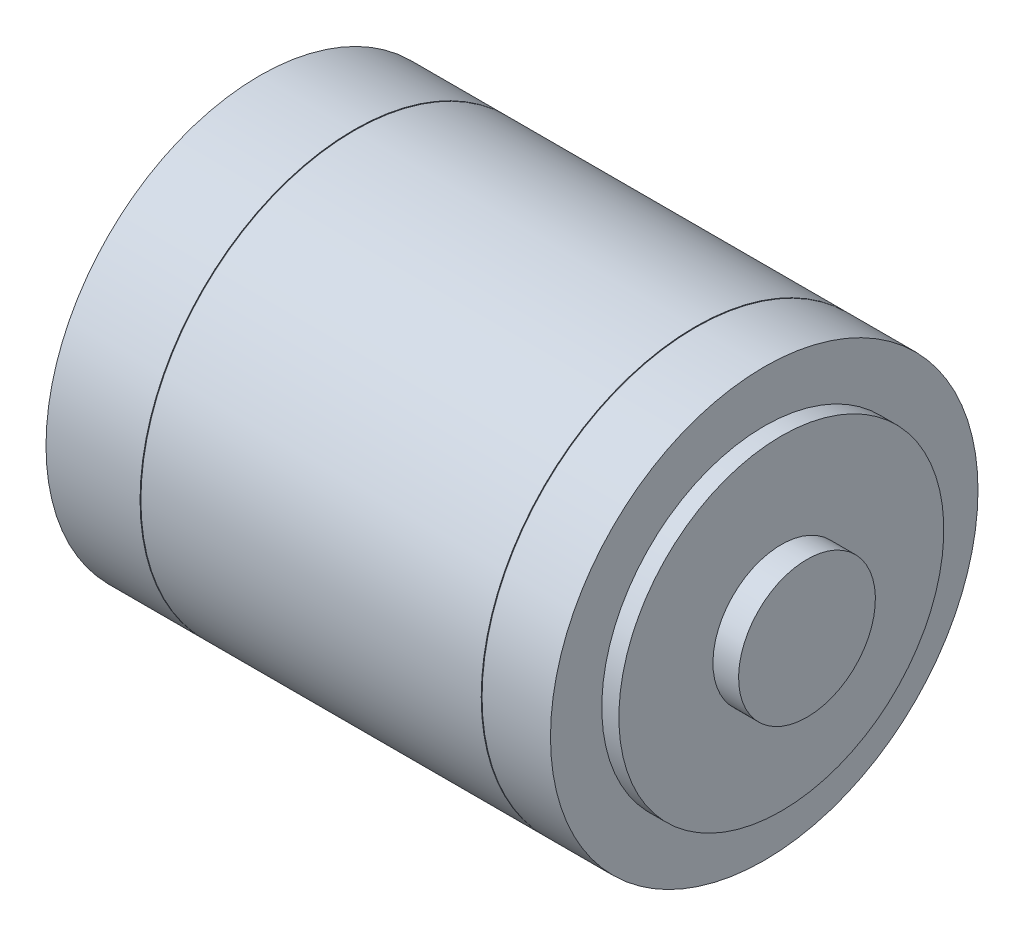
SolidWorks part; units mm, degrees
ref_plane "Plan1" through (0, 0, 0) normal (0, 0, 1) x (1, 0, 0)
ref_plane "Plan2" through (0, 0, 0) normal (0, 1, 0) x (1, 0, 0)
ref_plane "Plan3" through (0, 0, 0) normal (1, 0, 0) x (0, 0, -1)
sketch "Esquisse1" plane through (0, 0, 0) normal (0, 0, 1) x (1, 0, 0)
  line L0 (-67, 0) -> (-67, 15)
  line L1 (-67, 15) -> (-64, 15)
  line L2 (-64, 15) -> (-64, 25)
  line L3 (-64, 25) -> (-53, 25)
  line L4 (-53, 25) -> (-53, 24.9)
  line L5 (-53, 24.9) -> (-52.9, 24.9)
  line L6 (-52.9, 24.9) -> (-52.9, 25)
  line L7 (-52.9, 25) -> (-13.1, 25)
  line L8 (-13.1, 25) -> (-13.1, 24.9)
  line L9 (-13.1, 24.9) -> (-13, 24.9)
  line L10 (-13, 24.9) -> (-13, 25)
  line L11 (-13, 25) -> (-5, 25)
  line L12 (-5, 25) -> (-5, 19)
  line L13 (-92, 0) -> (31.2, 0) construction
  line L14 (-5, 19) -> (-3, 19)
  line L15 (-3, 19) -> (-3, 8)
  line L16 (-3, 8) -> (0, 8)
  line L17 (0, 8) -> (0, 0)
  line L20 (-67, 0) -> (0, 0)
  dimension "D1" = 3
  dimension "D2" = 15
  dimension "D3" = 25
  dimension "D4" = 0.1
  dimension "D5" = 0.1
  dimension "D6" = 0.1
  dimension "D7" = 0.1
  dimension "D8" = 25
  dimension "D9" = 25
  dimension "D10" = 8
  dimension "D11" = 11
  dimension "D12" = 2
  dimension "D13" = 19
  dimension "D14" = 3
  dimension "D15" = 8
  dimension "D16" = 59
revolve "Base-Révolution" add sketch "Esquisse1" angle 360 about L13
shell "Coque2" thickness 8
sketch "Esquisse2" plane through (-64, 0, 0) normal (-1, 0, 0) x (0, 0, 1)
  line L0 (0, 0) -> (0, 20) construction
  circle A0 centre (0, 0) radius 20 construction
  point P4 (0, 20)
  dimension "D1" = 40
hole_wizard "Trou taraudé M5x0.81" positions "Esquisse3" profile "Esquisse4" tap size "M5x0.8" standard "ISO"
sketch "Esquisse3" plane through (-64, 0, 0) normal (-1, 0, 0) x (0, 0, 1)
  point P0 (0, 20)
sketch "Esquisse4" plane through (-64, 20, 0) normal (0, 1, 0) x (0, 0, 1)
  line L0 (0, 0) -> (0, 15.2124)
  line L1 (0, 15.2124) -> (2.1, 14)
  line L2 (2.1, 14) -> (2.1, 0)
  line L5 (2.1, 0) -> (0, 0)
  line L10 (0, 15.2124) -> (-2.1, 14) construction
  line L11 (0, -6.35) -> (0, 107.95) construction
  dimension "Diamètre du trou pour taraudage" = 4.2
  dimension "Profondeur du trou pour taraudage" = 14
  dimension "Angle de pointe" = 120
pattern_circular "Répétition circulaire1" count 6 every 60 about axis through (-92, 0, 0) along (1, 0, 0)
chamfer "Chanfrein1" distance 0.5 angle 45
